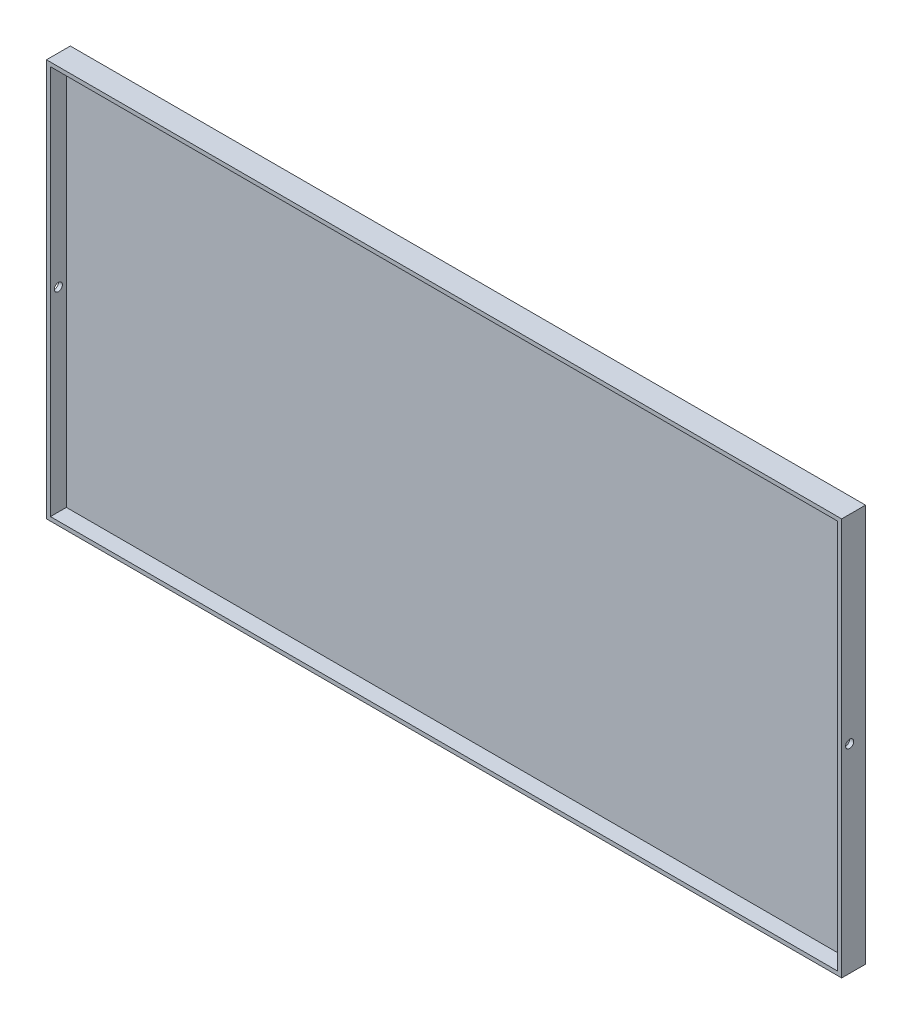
SolidWorks part; units mm, degrees
ref_plane "Front Plane" through (0, 0, 0) normal (0, 0, 1) x (1, 0, 0)
ref_plane "Top Plane" through (0, 0, 0) normal (0, 1, 0) x (1, 0, 0)
ref_plane "Right Plane" through (0, 0, 0) normal (1, 0, 0) x (0, 0, -1)
sketch "Sketch1" plane through (0, 0, 0) normal (0, 0, 1) x (1, 0, 0)
  line L1 (-500, 250) -> (500, 250)
  line L2 (-500, 250) -> (-500, -250)
  line L3 (-500, -250) -> (500, -250)
  line L4 (500, 250) -> (500, -250)
  line L5 (-500, 250) -> (500, -250) construction
  line L6 (-500, -250) -> (500, 250) construction
  point P0 (0, 0)
  dimension "D1" = 1000
  dimension "D2" = 500
extrude "Boss-Extrude1" add sketch "Sketch1" along normal blind 20
sketch "Sketch2" plane through (0, 0, 20) normal (0, 0, 1) x (1, 0, 0)
  line L1 (-495, 245) -> (495, 245)
  line L2 (-495, 245) -> (-495, -245)
  line L3 (-495, -245) -> (495, -245)
  line L4 (495, 245) -> (495, -245)
  line L5 (-495, 245) -> (495, -245) construction
  line L6 (-495, -245) -> (495, 245) construction
  point P0 (0, 0)
  dimension "D1" = 990
  dimension "D2" = 490
extrude "Cut-Extrude1" cut sketch "Sketch2" against normal through all
sketch "Sketch4" plane through (-500, 0, 0) normal (-1, 0, 0) x (0, 0, 1)
  circle A0 centre (10, 0) radius 5.08
extrude "Cut-Extrude2" cut sketch "Sketch4" against normal blind 10
sketch "Sketch5" plane through (500, 0, 0) normal (1, 0, 0) x (0, 0, -1)
  circle A0 centre (-10, 0) radius 5.08
extrude "Cut-Extrude3" cut sketch "Sketch5" against normal blind 10
sketch "Sketch6" plane through (0, 0, 0) normal (0, 0, 1) x (1, 0, 0)
  line L1 (500, 250) -> (-500, 250)
  line L2 (500, 250) -> (500, -250)
  line L3 (500, -250) -> (-500, -250)
  line L4 (-500, 250) -> (-500, -250)
  line L5 (500, 250) -> (-500, -250) construction
  line L6 (500, -250) -> (-500, 250) construction
  point P0 (0, 0)
  dimension "D1" = 500
  dimension "D2" = 1000
extrude "Boss-Extrude3" add sketch "Sketch6" against normal blind 10
